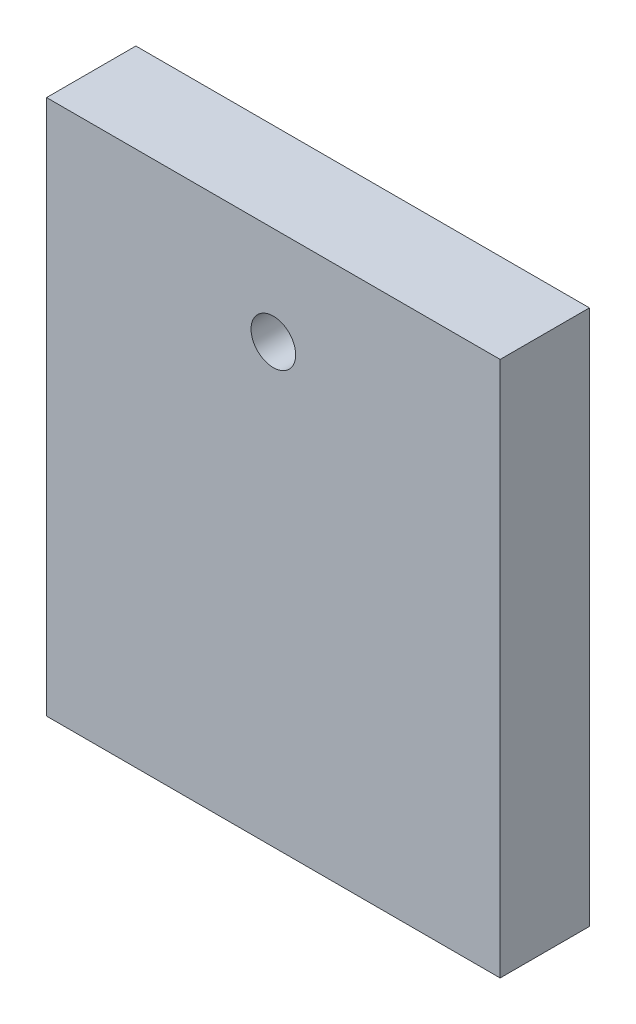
SolidWorks part; units mm, degrees
ref_plane "Front Plane" through (0, 0, 0) normal (0, 0, 1) x (1, 0, 0)
ref_plane "Top Plane" through (0, 0, 0) normal (0, 1, 0) x (1, 0, 0)
ref_plane "Right Plane" through (0, 0, 0) normal (1, 0, 0) x (0, 0, -1)
sketch "Sketch1" plane through (0, 0, 0) normal (0, 0, 1) x (1, 0, 0)
  line L0 (25.4, 0) -> (25.4, 60) construction
  line L1 (0, 0) -> (50.8, 0)
  line L2 (0, 0) -> (0, 60)
  line L3 (0, 60) -> (50.8, 60)
  line L4 (50.8, 0) -> (50.8, 60)
  circle A0 centre (25.4, 49) radius 2.5
  dimension "D4" = 5
  dimension "D1" = 50.8
  dimension "D2" = 60
  dimension "D3" = 49
extrude "Boss-Extrude1" add sketch "Sketch1" along normal blind 10
